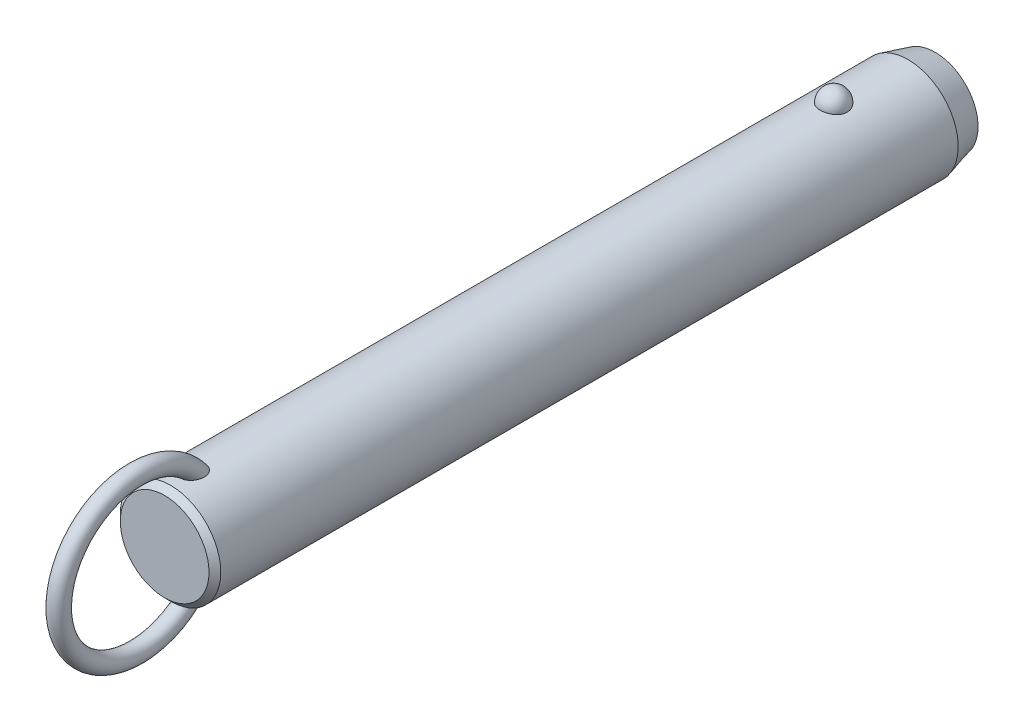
SolidWorks part; units mm, degrees
ref_plane "Front Plane" through (0, 0, 0) normal (0, 0, 1) x (1, 0, 0)
ref_plane "Top Plane" through (0, 0, 0) normal (0, 1, 0) x (1, 0, 0)
ref_plane "Right Plane" through (0, 0, 0) normal (1, 0, 0) x (0, 0, -1)
sketch "Sketch2" plane through (0, 0, 0) normal (0, 0, 1) x (1, 0, 0)
  circle A0 centre (0, 0) radius 11.1
  point P3 (0, 11.1)
  dimension "D1" = 22.2
extrude "Boss-Extrude1" add sketch "Sketch2" along normal blind 132.1
sketch "Sketch3" plane through (0, 0, 0) normal (0, 0, -1) x (-1, 0, 0)
  circle A0 centre (0, 0) radius 11.1
  dimension "D1" = 22.2
extrude "Boss-Extrude2" add sketch "Sketch3" along normal blind 25.4
chamfer "Chamfer1" distance 6 angle 15 1 edges at (-11.1, 0, -25.4)
sketch "Sketch12" plane through (0, 0, 0) normal (1, 0, 0) x (0, 0, -1)
  line L0 (-132.1, 11.1) -> (-132.1, -11.1) construction
  point P0 (-132.1, 0)
sketch "Sketch13" plane through (0, 0, 0) normal (1, 0, 0) x (0, 0, -1)
  circle A0 centre (-151.15, 0) radius 19.05
  point P2 (-132.1, 0)
  dimension "D1" = 38.1
sketch "Sketch14" plane through (0, 0, 0) normal (0, 1, 0) x (1, 0, 0)
  circle A0 centre (0, -134.1) radius 2
  point P2 (0, -132.1)
  dimension "D1" = 4
sweep "Sweep1" add profiles "Sketch14" path "Sketch13"
sketch "Sketch15" plane through (0, 0, 132.1) normal (0, 0, 1) x (1, 0, 0)
  circle A0 centre (0, 0) radius 11.1
  dimension "D1" = 22.2
extrude "Boss-Extrude3" add sketch "Sketch15" along normal blind 12.7
chamfer "Chamfer2" distance 1.3 angle 45 1 edges at (11.1, 0, 144.8)
sketch "Sketch18" plane through (0, 0, 0) normal (1, 0, 0) x (0, 0, -1)
  line L0 (19.4, 11.1) -> (-135.668, 11.1) construction
  line L1 (3, 14.1) -> (3, 8.1)
  line L2 (-135.668, -11.1) -> (19.4, -11.1) construction
  arc A0 (3, 14.1) -> (3, 8.1) centre (3, 11.1) ccw
  point P4 (0, 11.1)
  dimension "D1" = 25.2
revolve "Revolve1" add sketch "Sketch18" angle 360 about L1
